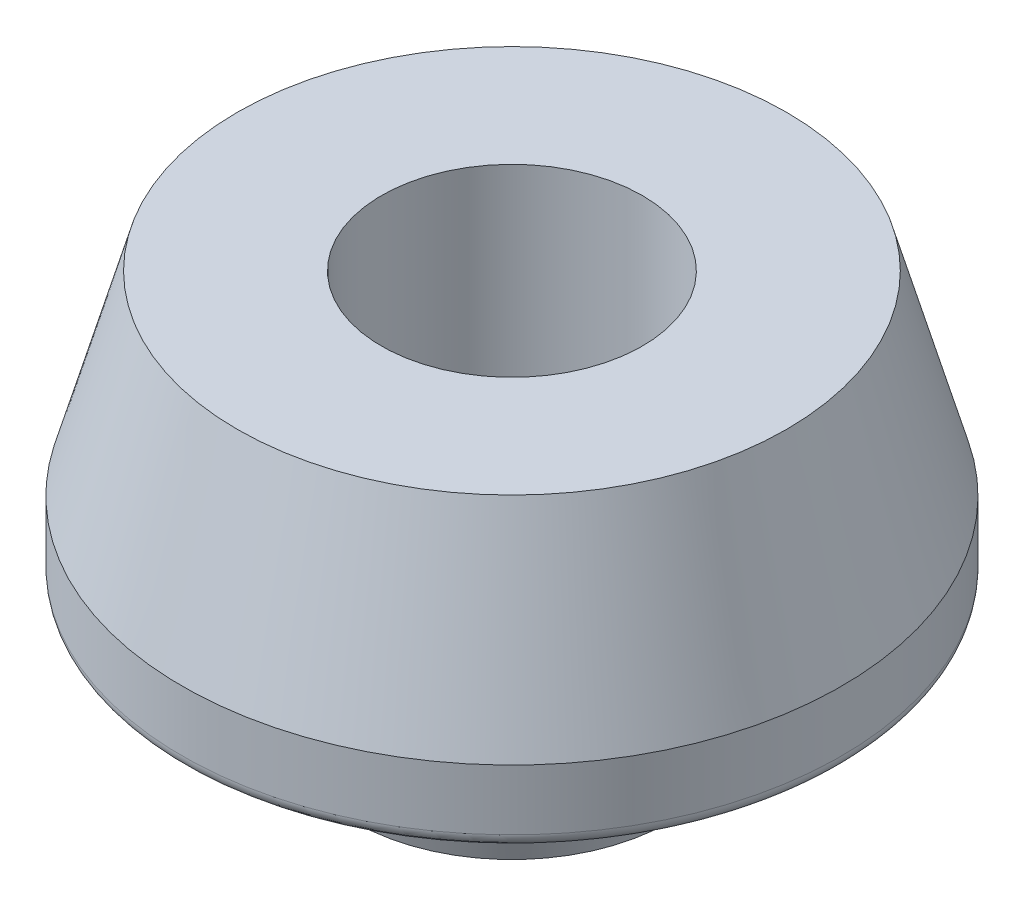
SolidWorks part; units mm, degrees
ref_plane "Front Plane" through (0, 0, 0) normal (0, 0, 1) x (1, 0, 0)
ref_plane "Top Plane" through (0, 0, 0) normal (0, 1, 0) x (1, 0, 0)
ref_plane "Right Plane" through (0, 0, 0) normal (1, 0, 0) x (0, 0, -1)
sketch "Sketch1" plane through (0, 0, 0) normal (0, 0, 1) x (1, 0, 0)
  line L0 (0, -14.5) -> (0, 0) construction
  line L1 (0, 0) -> (10, 0) construction
  line L2 (10, 0) -> (4.75, 0)
  line L3 (4.75, 0) -> (4.75, -14.5)
  line L4 (4.75, -14.5) -> (5.75, -14.5)
  line L5 (5.75, -14.5) -> (7, -9.8)
  line L6 (7, -9.8) -> (12, -9.8)
  line L7 (12, -9.8) -> (12, -7.1)
  line L8 (12, -7.1) -> (10, 0)
  dimension "D1" = 14.5
  dimension "D2" = 10
  dimension "D3" = 5.25
  dimension "D4" = 9.8
  dimension "D5" = 1
  dimension "D6" = 5
  dimension "D7" = 2.7
  dimension "D8" = 12
revolve "Revolve1" add sketch "Sketch1" angle 360 about L0
fillet "Fillet1" radius 0.5 1 edges at (0, -9.8, -12)
